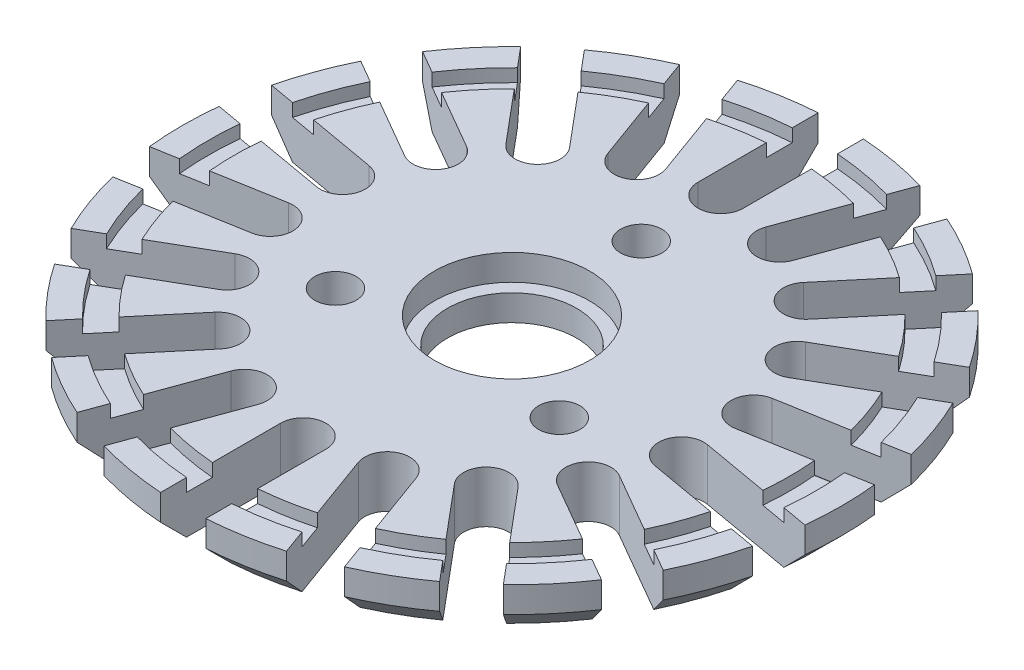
SolidWorks part; units mm, degrees
ref_plane "Plano frontal" through (0, 0, 0) normal (0, 0, 1) x (1, 0, 0)
ref_plane "Plano superior" through (0, 0, 0) normal (0, 1, 0) x (1, 0, 0)
ref_plane "Plano direito" through (0, 0, 0) normal (1, 0, 0) x (0, 0, -1)
sketch "Esboço1" plane through (0, 0, 0) normal (0, 1, 0) x (1, 0, 0)
  line L0 (1.75, 16.15) -> (1.75, 25.4399)
  line L1 (-1.75, 16.15) -> (-1.75, 25.4399)
  line L2 (3.8792, 15.7746) -> (7.0565, 24.5042)
  line L3 (7.1681, 14.5775) -> (10.3454, 23.3071)
  line L4 (9.0404, 13.4965) -> (15.0119, 20.613)
  line L5 (11.7216, 11.2467) -> (17.693, 18.3632)
  line L6 (13.1113, 9.5905) -> (21.1566, 14.2355)
  line L7 (14.8613, 6.5595) -> (22.9066, 11.2044)
  line L8 (15.6008, 4.5278) -> (24.7495, 6.141)
  line L9 (16.2085, 1.081) -> (25.3573, 2.6942)
  line L10 (16.2085, -1.081) -> (25.3573, -2.6942)
  line L11 (15.6008, -4.5278) -> (24.7495, -6.141)
  line L12 (14.8613, -6.5595) -> (22.9066, -11.2044)
  line L13 (13.1113, -9.5905) -> (21.1566, -14.2355)
  line L14 (11.7216, -11.2467) -> (17.693, -18.3632)
  line L15 (9.0404, -13.4965) -> (15.0119, -20.613)
  line L16 (7.1681, -14.5775) -> (10.3454, -23.3071)
  line L17 (3.8792, -15.7746) -> (7.0565, -24.5042)
  line L18 (1.75, -16.15) -> (1.75, -25.4399)
  line L19 (-1.75, -16.15) -> (-1.75, -25.4399)
  line L20 (-3.8792, -15.7746) -> (-7.0565, -24.5042)
  line L21 (-7.1681, -14.5775) -> (-10.3454, -23.3071)
  line L22 (-9.0404, -13.4965) -> (-15.0119, -20.613)
  line L23 (-11.7216, -11.2467) -> (-17.693, -18.3632)
  line L24 (-13.1113, -9.5905) -> (-21.1566, -14.2355)
  line L25 (-14.8613, -6.5595) -> (-22.9066, -11.2044)
  line L26 (-15.6008, -4.5278) -> (-24.7495, -6.141)
  line L27 (-16.2085, -1.081) -> (-25.3573, -2.6942)
  line L28 (-16.2085, 1.081) -> (-25.3573, 2.6942)
  line L29 (-15.6008, 4.5278) -> (-24.7495, 6.141)
  line L30 (-14.8613, 6.5595) -> (-22.9066, 11.2044)
  line L31 (-13.1113, 9.5905) -> (-21.1566, 14.2355)
  line L32 (-11.7216, 11.2467) -> (-17.693, 18.3632)
  line L33 (-9.0404, 13.4965) -> (-15.0119, 20.613)
  line L34 (-7.1681, 14.5775) -> (-10.3454, 23.3071)
  line L35 (-3.8792, 15.7746) -> (-7.0565, 24.5042)
  arc A0 (-1.75, 25.4399) -> (-7.0565, 24.5042) centre (0, 0) ccw
  circle A1 centre (0, 0) radius 5
  circle A2 centre (0, 0) radius 16.15 construction
  arc A3 (-1.75, 16.15) -> (1.75, 16.15) centre (0, 16.15) ccw
  arc A4 (3.8792, 15.7746) -> (7.1681, 14.5775) centre (5.5236, 15.176) ccw
  arc A5 (9.0404, 13.4965) -> (11.7216, 11.2467) centre (10.381, 12.3716) ccw
  arc A6 (13.1113, 9.5905) -> (14.8613, 6.5595) centre (13.9863, 8.075) ccw
  arc A7 (15.6008, 4.5278) -> (16.2085, 1.081) centre (15.9046, 2.8044) ccw
  arc A8 (16.2085, -1.081) -> (15.6008, -4.5278) centre (15.9046, -2.8044) ccw
  arc A9 (14.8613, -6.5595) -> (13.1113, -9.5905) centre (13.9863, -8.075) ccw
  arc A10 (11.7216, -11.2467) -> (9.0404, -13.4965) centre (10.381, -12.3716) ccw
  arc A11 (7.1681, -14.5775) -> (3.8792, -15.7746) centre (5.5236, -15.176) ccw
  arc A12 (1.75, -16.15) -> (-1.75, -16.15) centre (0, -16.15) ccw
  arc A13 (-3.8792, -15.7746) -> (-7.1681, -14.5775) centre (-5.5236, -15.176) ccw
  arc A14 (-9.0404, -13.4965) -> (-11.7216, -11.2467) centre (-10.381, -12.3716) ccw
  arc A15 (-13.1113, -9.5905) -> (-14.8613, -6.5595) centre (-13.9863, -8.075) ccw
  arc A16 (-15.6008, -4.5278) -> (-16.2085, -1.081) centre (-15.9046, -2.8044) ccw
  arc A17 (-16.2085, 1.081) -> (-15.6008, 4.5278) centre (-15.9046, 2.8044) ccw
  arc A18 (-14.8613, 6.5595) -> (-13.1113, 9.5905) centre (-13.9863, 8.075) ccw
  arc A19 (-11.7216, 11.2467) -> (-9.0404, 13.4965) centre (-10.381, 12.3716) ccw
  arc A20 (-7.1681, 14.5775) -> (-3.8792, 15.7746) centre (-5.5236, 15.176) ccw
  arc A21 (-10.3454, 23.3071) -> (-15.0119, 20.613) centre (0, 0) ccw
  arc A22 (7.0565, 24.5042) -> (1.75, 25.4399) centre (0, 0) ccw
  arc A23 (-17.693, 18.3632) -> (-21.1566, 14.2355) centre (0, 0) ccw
  arc A24 (-22.9066, 11.2044) -> (-24.7495, 6.141) centre (0, 0) ccw
  arc A25 (-25.3573, 2.6942) -> (-25.3573, -2.6942) centre (0, 0) ccw
  arc A26 (-24.7495, -6.141) -> (-22.9066, -11.2044) centre (0, 0) ccw
  arc A27 (-21.1566, -14.2355) -> (-17.693, -18.3632) centre (0, 0) ccw
  arc A28 (-15.0119, -20.613) -> (-10.3454, -23.3071) centre (0, 0) ccw
  arc A29 (-7.0565, -24.5042) -> (-1.75, -25.4399) centre (0, 0) ccw
  arc A30 (1.75, -25.4399) -> (7.0565, -24.5042) centre (0, 0) ccw
  arc A31 (10.3454, -23.3071) -> (15.0119, -20.613) centre (0, 0) ccw
  arc A32 (17.693, -18.3632) -> (21.1566, -14.2355) centre (0, 0) ccw
  arc A33 (22.9066, -11.2044) -> (24.7495, -6.141) centre (0, 0) ccw
  arc A34 (25.3573, -2.6942) -> (25.3573, 2.6942) centre (0, 0) ccw
  arc A35 (24.7495, 6.141) -> (22.9066, 11.2044) centre (0, 0) ccw
  arc A36 (21.1566, 14.2355) -> (17.693, 18.3632) centre (0, 0) ccw
  arc A37 (15.0119, 20.613) -> (10.3454, 23.3071) centre (0, 0) ccw
  dimension "D1" = 51
  dimension "D2" = 10
  dimension "D3" = 32.3
  dimension "D4" = 3.5
  dimension "D5" = 9.2899
extrude "Ressalto-extrusão1" add sketch "Esboço1" along normal blind 4
sketch "Esboço2" plane through (0, 4, 0) normal (0, 1, 0) x (1, 0, 0)
  circle A0 centre (0, 0) radius 6
  dimension "D1" = 12
extrude "Corte-extrusão1" cut sketch "Esboço2" against normal blind 2
sketch "Esboço3" plane through (0, 4, 0) normal (0, 1, 0) x (1, 0, 0)
  circle A0 centre (0, 0) radius 23.5
  circle A1 centre (0, 0) radius 21.5
  dimension "D1" = 47
  dimension "D2" = 43
extrude "Corte-extrusão2" cut sketch "Esboço3" against normal blind 1
chamfer "Chanfro1" distance 2 angle 45 18 edges at (25.5, 0, 0) (23.9622, 0, 8.7215) (19.5341, 0, 16.3911) (12.75, 0, 22.0836) (4.428, 0, 25.1126) (-4.428, 0, 25.1126) (-12.75, 0, 22.0836) (-19.5341, 0, 16.3911) (-23.9622, 0, 8.7215) (-25.5, 0, 0) (-23.9622, 0, -8.7215) (-19.5341, 0, -16.3911) (-12.75, 0, -22.0836) (-4.428, 0, -25.1126) (4.428, 0, -25.1126) (12.75, 0, -22.0836) (19.5341, 0, -16.3911) (23.9622, 0, -8.7215)
sketch "Esboço4" plane through (0, 0, 0) normal (0, -1, 0) x (1, 0, 0)
  line L0 (0, -12.8935) -> (0, 12.7623) construction
  circle A0 centre (0, 0) radius 10 construction
  circle A1 centre (0, -10) radius 1.6
  circle A2 centre (-8.6603, 5) radius 1.6
  circle A3 centre (8.6603, 5) radius 1.6
  dimension "D1" = 20
  dimension "D2" = 3.2
  dimension "D4" = 10
  dimension "D5" = 10
  dimension "D3" = 3
extrude "Corte-extrusão3" cut sketch "Esboço4" against normal through all
